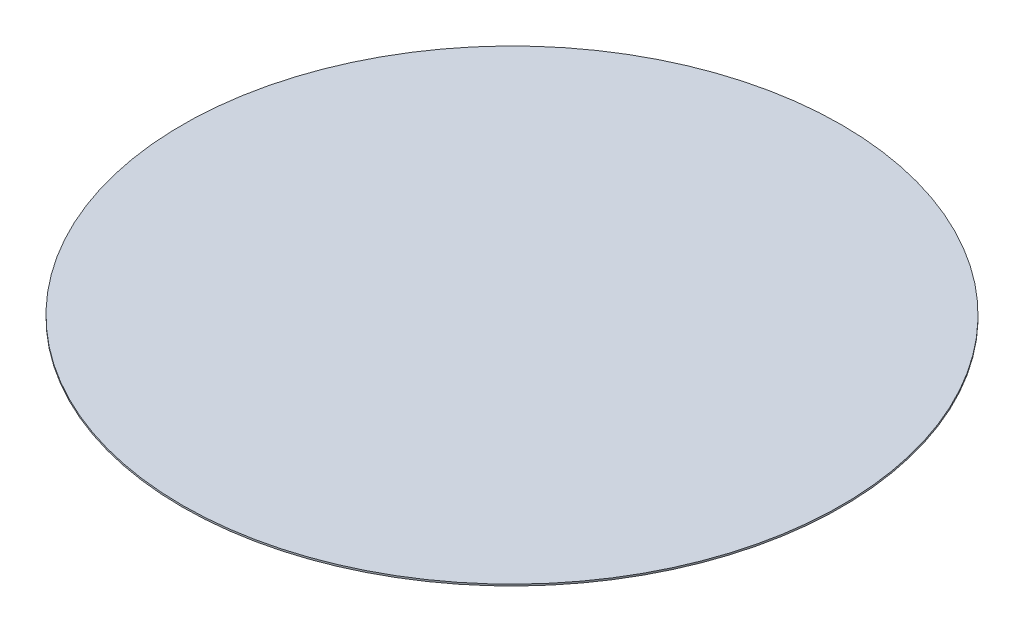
SolidWorks part; units mm, degrees
ref_plane "Front Plane" through (0, 0, 0) normal (0, 0, 1) x (1, 0, 0)
ref_plane "Top Plane" through (0, 0, 0) normal (0, 1, 0) x (1, 0, 0)
ref_plane "Right Plane" through (0, 0, 0) normal (1, 0, 0) x (0, 0, -1)
sketch "Sketch1" plane through (0, 0, 0) normal (0, 1, 0) x (1, 0, 0)
  circle A0 centre (0, 0) radius 70
  dimension "D1" = 140
extrude "Boss-Extrude1" add sketch "Sketch1" along normal blind 0.35
